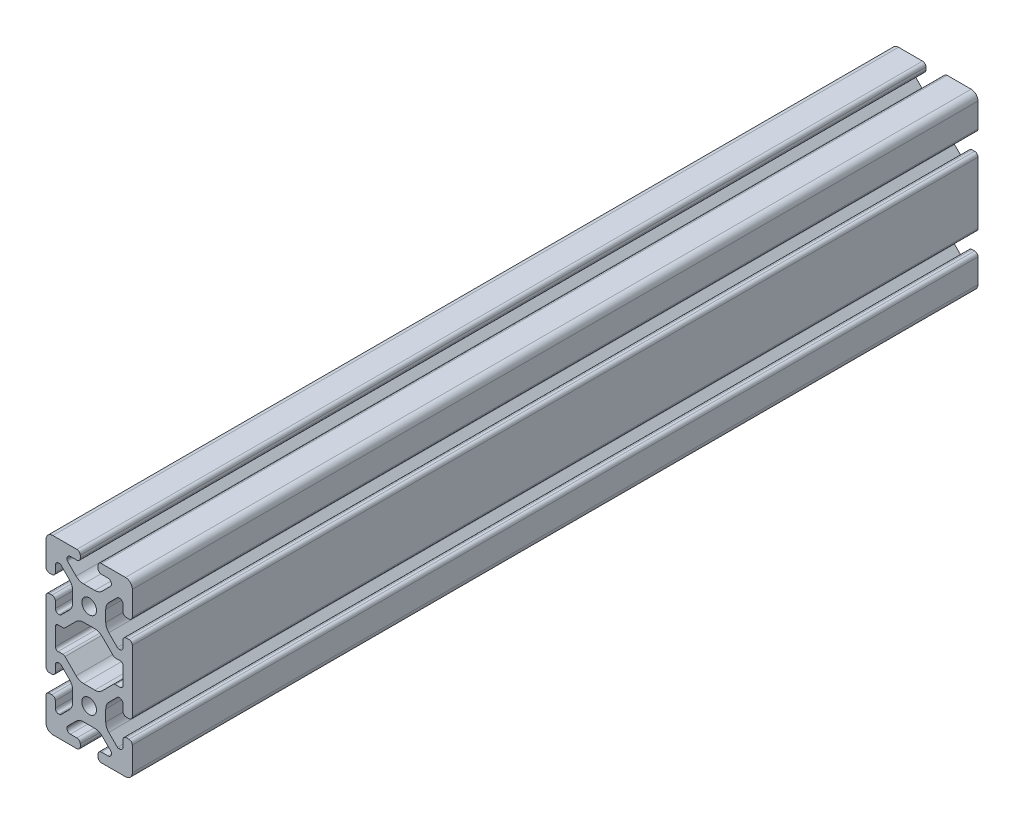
SolidWorks part; units mm, degrees
ref_plane "Front Plane" through (0, 0, 0) normal (0, 0, 1) x (1, 0, 0)
ref_plane "Top Plane" through (0, 0, 0) normal (0, 1, 0) x (1, 0, 0)
ref_plane "Right Plane" through (0, 0, 0) normal (1, 0, 0) x (0, 0, -1)
ref_plane "Plane1" through (0, 0, -3048) normal (0, 0, -1) x (-1, 0, 0)
sketch "Sketch1" plane through (0, 0, -3048) normal (0, 0, -1) x (-1, 0, 0)
  line L0 (14.41, 14.6586) -> (12.13, 14.6586)
  line L1 (11.1794, 14.2308) -> (6.0551, 9.1098)
  line L2 (2.6153, 7.685) -> (-2.6153, 7.685)
  line L3 (-6.0551, 9.1098) -> (-11.232, 14.2867)
  line L4 (-12.13, 14.6586) -> (-14.41, 14.6586)
  line L5 (-15.68, 15.9286) -> (-15.68, 24.0714)
  line L6 (-14.41, 25.3414) -> (-12.13, 25.3414)
  line L7 (-11.232, 25.7133) -> (-6.0551, 30.8902)
  line L8 (-2.6153, 32.315) -> (2.6176, 32.315)
  line L9 (6.0573, 30.8902) -> (11.1842, 25.7634)
  line L10 (12.13, 25.3414) -> (14.41, 25.3414)
  line L11 (15.68, 24.0714) -> (15.68, 15.9286)
  line L12 (16.83, 60) -> (5.6904, 60)
  line L13 (4.1204, 58.43) -> (4.1204, 57.25)
  line L14 (5.6904, 55.68) -> (8.7154, 55.68)
  line L15 (10.2854, 54.11) -> (10.2854, 53.6549)
  line L16 (10.0628, 53.1175) -> (6.0551, 49.1098)
  line L17 (2.6153, 47.685) -> (-2.6153, 47.685)
  line L18 (-6.0551, 49.1098) -> (-10.0628, 53.1175)
  line L19 (-10.2854, 53.6549) -> (-10.2854, 54.11)
  line L20 (-8.7154, 55.68) -> (-5.6904, 55.68)
  line L21 (-4.1204, 57.25) -> (-4.1204, 58.43)
  line L22 (-5.6904, 60) -> (-16.83, 60)
  line L23 (-20, 56.83) -> (-20, 45.6904)
  line L24 (-18.43, 44.1204) -> (-17.25, 44.1204)
  line L25 (-15.68, 45.6904) -> (-15.68, 48.7154)
  line L26 (-14.11, 50.2854) -> (-13.6527, 50.2854)
  line L27 (-13.1153, 50.0628) -> (-9.1098, 46.0573)
  line L28 (-7.685, 42.6176) -> (-7.685, 37.3847)
  line L29 (-9.1098, 33.9449) -> (-13.1175, 29.9372)
  line L30 (-13.6549, 29.7146) -> (-14.11, 29.7146)
  line L31 (-15.68, 31.2846) -> (-15.68, 34.3096)
  line L32 (-17.25, 35.8796) -> (-18.43, 35.8796)
  line L33 (-20, 34.3096) -> (-20, 5.6904)
  line L34 (-18.43, 4.1204) -> (-17.25, 4.1204)
  line L35 (-15.68, 5.6904) -> (-15.68, 8.7154)
  line L36 (-14.11, 10.2854) -> (-13.6549, 10.2854)
  line L37 (-13.1175, 10.0628) -> (-9.1098, 6.0551)
  line L38 (-7.685, 2.6153) -> (-7.685, -2.6153)
  line L39 (-9.1098, -6.0551) -> (-13.1175, -10.0628)
  line L40 (-13.6549, -10.2854) -> (-14.11, -10.2854)
  line L41 (-15.68, -8.7154) -> (-15.68, -5.6904)
  line L42 (-17.25, -4.1204) -> (-18.43, -4.1204)
  line L43 (-20, -5.6904) -> (-20, -16.83)
  line L44 (-16.83, -20) -> (-5.6904, -20)
  line L45 (-4.1204, -18.43) -> (-4.1204, -17.25)
  line L46 (-5.6904, -15.68) -> (-8.7154, -15.68)
  line L47 (-10.2854, -14.11) -> (-10.2854, -13.6549)
  line L48 (-10.0628, -13.1175) -> (-6.0551, -9.1098)
  line L49 (-2.6153, -7.685) -> (2.6153, -7.685)
  line L50 (6.0551, -9.1098) -> (10.0628, -13.1175)
  line L51 (10.2854, -13.6549) -> (10.2854, -14.11)
  line L52 (8.7154, -15.68) -> (5.6904, -15.68)
  line L53 (4.1204, -17.25) -> (4.1204, -18.43)
  line L54 (5.6904, -20) -> (16.83, -20)
  line L55 (20, -16.83) -> (20, -5.6904)
  line L56 (18.43, -4.1204) -> (17.25, -4.1204)
  line L57 (15.68, -5.6904) -> (15.68, -8.7154)
  line L58 (14.11, -10.2854) -> (13.6549, -10.2854)
  line L59 (13.1175, -10.0628) -> (9.1098, -6.0551)
  line L60 (7.685, -2.6153) -> (7.685, 2.6153)
  line L61 (9.1098, 6.0551) -> (13.1175, 10.0628)
  line L62 (13.6549, 10.2854) -> (14.11, 10.2854)
  line L63 (15.68, 8.7154) -> (15.68, 5.6904)
  line L64 (17.25, 4.1204) -> (18.43, 4.1204)
  line L65 (20, 5.6904) -> (20, 34.3096)
  line L66 (18.43, 35.8796) -> (17.25, 35.8796)
  line L67 (15.68, 34.3096) -> (15.68, 31.2846)
  line L68 (14.11, 29.7146) -> (13.6549, 29.7146)
  line L69 (13.1175, 29.9372) -> (9.1098, 33.9449)
  line L70 (7.685, 37.3847) -> (7.685, 42.6153)
  line L71 (9.1098, 46.0551) -> (13.1175, 50.0628)
  line L72 (13.6549, 50.2854) -> (14.11, 50.2854)
  line L73 (15.68, 48.7154) -> (15.68, 45.6904)
  line L74 (17.25, 44.1204) -> (18.43, 44.1204)
  line L75 (20, 45.6904) -> (20, 56.83)
  arc A0 (15.68, 15.9286) -> (14.41, 14.6586) centre (14.41, 15.9286) cw
  arc A1 (12.13, 14.6586) -> (11.1794, 14.2308) centre (12.13, 13.3886) ccw
  arc A2 (6.0551, 9.1098) -> (2.6153, 7.685) centre (2.6153, 12.5496) cw
  arc A3 (-2.6153, 7.685) -> (-6.0551, 9.1098) centre (-2.6153, 12.5496) cw
  arc A4 (-11.232, 14.2867) -> (-12.13, 14.6586) centre (-12.13, 13.3886) ccw
  arc A5 (-14.41, 14.6586) -> (-15.68, 15.9286) centre (-14.41, 15.9286) cw
  arc A6 (-15.68, 24.0714) -> (-14.41, 25.3414) centre (-14.41, 24.0714) cw
  arc A7 (-12.13, 25.3414) -> (-11.232, 25.7133) centre (-12.13, 26.6114) ccw
  arc A8 (-6.0551, 30.8902) -> (-2.6153, 32.315) centre (-2.6153, 27.4504) cw
  arc A9 (2.6176, 32.315) -> (6.0573, 30.8902) centre (2.6176, 27.4504) cw
  arc A10 (11.1842, 25.7634) -> (12.13, 25.3414) centre (12.13, 26.6123) ccw
  arc A11 (14.41, 25.3414) -> (15.68, 24.0714) centre (14.41, 24.0714) cw
  circle A12 centre (0, 0) radius 3.405
  circle A13 centre (0, 40) radius 3.405
  arc A14 (5.6904, 60) -> (4.1204, 58.43) centre (5.6904, 58.43) ccw
  arc A15 (4.1204, 57.25) -> (5.6904, 55.68) centre (5.6904, 57.25) ccw
  arc A16 (8.7154, 55.68) -> (10.2854, 54.11) centre (8.7154, 54.11) cw
  arc A17 (10.2854, 53.6549) -> (10.0628, 53.1175) centre (9.5254, 53.6549) cw
  arc A18 (6.0551, 49.1098) -> (2.6153, 47.685) centre (2.6153, 52.5496) cw
  arc A19 (-2.6153, 47.685) -> (-6.0551, 49.1098) centre (-2.6153, 52.5496) cw
  arc A20 (-10.0628, 53.1175) -> (-10.2854, 53.6549) centre (-9.5254, 53.6549) cw
  arc A21 (-10.2854, 54.11) -> (-8.7154, 55.68) centre (-8.7154, 54.11) cw
  arc A22 (-5.6904, 55.68) -> (-4.1204, 57.25) centre (-5.6904, 57.25) ccw
  arc A23 (-4.1204, 58.43) -> (-5.6904, 60) centre (-5.6904, 58.43) ccw
  arc A24 (-16.83, 60) -> (-20, 56.83) centre (-16.83, 56.83) ccw
  arc A25 (-20, 45.6904) -> (-18.43, 44.1204) centre (-18.43, 45.6904) ccw
  arc A26 (-17.25, 44.1204) -> (-15.68, 45.6904) centre (-17.25, 45.6904) ccw
  arc A27 (-15.68, 48.7154) -> (-14.11, 50.2854) centre (-14.11, 48.7154) cw
  arc A28 (-13.6527, 50.2854) -> (-13.1153, 50.0628) centre (-13.6527, 49.5254) cw
  arc A29 (-9.1098, 46.0573) -> (-7.685, 42.6176) centre (-12.5496, 42.6176) cw
  arc A30 (-7.685, 37.3847) -> (-9.1098, 33.9449) centre (-12.5496, 37.3847) cw
  arc A31 (-13.1175, 29.9372) -> (-13.6549, 29.7146) centre (-13.6549, 30.4746) cw
  arc A32 (-14.11, 29.7146) -> (-15.68, 31.2846) centre (-14.11, 31.2846) cw
  arc A33 (-15.68, 34.3096) -> (-17.25, 35.8796) centre (-17.25, 34.3096) ccw
  arc A34 (-18.43, 35.8796) -> (-20, 34.3096) centre (-18.43, 34.3096) ccw
  arc A35 (-20, 5.6904) -> (-18.43, 4.1204) centre (-18.43, 5.6904) ccw
  arc A36 (-17.25, 4.1204) -> (-15.68, 5.6904) centre (-17.25, 5.6904) ccw
  arc A37 (-15.68, 8.7154) -> (-14.11, 10.2854) centre (-14.11, 8.7154) cw
  arc A38 (-13.6549, 10.2854) -> (-13.1175, 10.0628) centre (-13.6549, 9.5254) cw
  arc A39 (-9.1098, 6.0551) -> (-7.685, 2.6153) centre (-12.5496, 2.6153) cw
  arc A40 (-7.685, -2.6153) -> (-9.1098, -6.0551) centre (-12.5496, -2.6153) cw
  arc A41 (-13.1175, -10.0628) -> (-13.6549, -10.2854) centre (-13.6549, -9.5254) cw
  arc A42 (-14.11, -10.2854) -> (-15.68, -8.7154) centre (-14.11, -8.7154) cw
  arc A43 (-15.68, -5.6904) -> (-17.25, -4.1204) centre (-17.25, -5.6904) ccw
  arc A44 (-18.43, -4.1204) -> (-20, -5.6904) centre (-18.43, -5.6904) ccw
  arc A45 (-20, -16.83) -> (-16.83, -20) centre (-16.83, -16.83) ccw
  arc A46 (-5.6904, -20) -> (-4.1204, -18.43) centre (-5.6904, -18.43) ccw
  arc A47 (-4.1204, -17.25) -> (-5.6904, -15.68) centre (-5.6904, -17.25) ccw
  arc A48 (-8.7154, -15.68) -> (-10.2854, -14.11) centre (-8.7154, -14.11) cw
  arc A49 (-10.2854, -13.6549) -> (-10.0628, -13.1175) centre (-9.5254, -13.6549) cw
  arc A50 (-6.0551, -9.1098) -> (-2.6153, -7.685) centre (-2.6153, -12.5496) cw
  arc A51 (2.6153, -7.685) -> (6.0551, -9.1098) centre (2.6153, -12.5496) cw
  arc A52 (10.0628, -13.1175) -> (10.2854, -13.6549) centre (9.5254, -13.6549) cw
  arc A53 (10.2854, -14.11) -> (8.7154, -15.68) centre (8.7154, -14.11) cw
  arc A54 (5.6904, -15.68) -> (4.1204, -17.25) centre (5.6904, -17.25) ccw
  arc A55 (4.1204, -18.43) -> (5.6904, -20) centre (5.6904, -18.43) ccw
  arc A56 (16.83, -20) -> (20, -16.83) centre (16.83, -16.83) ccw
  arc A57 (20, -5.6904) -> (18.43, -4.1204) centre (18.43, -5.6904) ccw
  arc A58 (17.25, -4.1204) -> (15.68, -5.6904) centre (17.25, -5.6904) ccw
  arc A59 (15.68, -8.7154) -> (14.11, -10.2854) centre (14.11, -8.7154) cw
  arc A60 (13.6549, -10.2854) -> (13.1175, -10.0628) centre (13.6549, -9.5254) cw
  arc A61 (9.1098, -6.0551) -> (7.685, -2.6153) centre (12.5496, -2.6153) cw
  arc A62 (7.685, 2.6153) -> (9.1098, 6.0551) centre (12.5496, 2.6153) cw
  arc A63 (13.1175, 10.0628) -> (13.6549, 10.2854) centre (13.6549, 9.5254) cw
  arc A64 (14.11, 10.2854) -> (15.68, 8.7154) centre (14.11, 8.7154) cw
  arc A65 (15.68, 5.6904) -> (17.25, 4.1204) centre (17.25, 5.6904) ccw
  arc A66 (18.43, 4.1204) -> (20, 5.6904) centre (18.43, 5.6904) ccw
  arc A67 (20, 34.3096) -> (18.43, 35.8796) centre (18.43, 34.3096) ccw
  arc A68 (17.25, 35.8796) -> (15.68, 34.3096) centre (17.25, 34.3096) ccw
  arc A69 (15.68, 31.2846) -> (14.11, 29.7146) centre (14.11, 31.2846) cw
  arc A70 (13.6549, 29.7146) -> (13.1175, 29.9372) centre (13.6549, 30.4746) cw
  arc A71 (9.1098, 33.9449) -> (7.685, 37.3847) centre (12.5496, 37.3847) cw
  arc A72 (7.685, 42.6153) -> (9.1098, 46.0551) centre (12.5496, 42.6153) cw
  arc A73 (13.1175, 50.0628) -> (13.6549, 50.2854) centre (13.6549, 49.5254) cw
  arc A74 (14.11, 50.2854) -> (15.68, 48.7154) centre (14.11, 48.7154) cw
  arc A75 (15.68, 45.6904) -> (17.25, 44.1204) centre (17.25, 45.6904) ccw
  arc A76 (18.43, 44.1204) -> (20, 45.6904) centre (18.43, 45.6904) ccw
  arc A77 (20, 56.83) -> (16.83, 60) centre (16.83, 56.83) ccw
extrude "Boss-Extrude1" add sketch "Sketch1" against normal blind 3048
ref_plane "2.5 ft cut1" through (0, 0, -762) normal (0, 0, 1) x (1, 0, 0)
ref_plane "2.5 ft cut2" through (0, 0, -1524) normal (0, 0, 1) x (1, 0, 0)
ref_plane "16.14 in cut3" through (0, 0, -1933.956) normal (0, 0, 1) x (1, 0, 0)
ref_plane "13 in cut4" through (0, 0, -2264.156) normal (0, 0, 1) x (1, 0, 0)
ref_plane "midplane cut5" through (0, 0, -2656.078) normal (0, 0, 1) x (1, 0, 0)
sketch "Sketch26" plane through (0, 0, -762) normal (0, 0, 1) x (1, 0, 0)
  line L0 (-20, -20.8001) -> (20, -20.8001)
  line L1 (-20, -20.8001) -> (-20, 60)
  line L2 (-20, 60) -> (20, 60)
  line L3 (20, -20.8001) -> (20, 60)
sketch "Sketch33" plane through (0, 0, -1524) normal (0, 0, 1) x (1, 0, 0)
  line L5 (-20, 60) -> (20, 60)
  line L6 (-20, 60) -> (-20, -20.8001)
  line L7 (-20, -20.8001) -> (20, -20.8001)
  line L8 (20, 60) -> (20, -20.8001)
sketch "Sketch41" plane through (0, 0, -1933.956) normal (0, 0, 1) x (1, 0, 0)
  line L0 (-20, -20.8001) -> (20, -20.8001)
  line L1 (-20, -20.8001) -> (-20, 60)
  line L2 (-20, 60) -> (20, 60)
  line L3 (20, -20.8001) -> (20, 60)
sketch "Sketch50" plane through (0, 0, -2264.156) normal (0, 0, 1) x (1, 0, 0)
  line L0 (-20, -20.8001) -> (20, -20.8001)
  line L1 (-20, -20.8001) -> (-20, 60)
  line L2 (-20, 60) -> (20, 60)
  line L3 (20, -20.8001) -> (20, 60)
sketch "Sketch51" plane through (0, 0, -2656.078) normal (0, 0, 1) x (1, 0, 0)
  line L1 (-20, 60) -> (20, 60)
  line L2 (-20, 60) -> (-20, -20.8001)
  line L3 (-20, -20.8001) -> (20, -20.8001)
  line L4 (20, 60) -> (20, -20.8001)
extrude "Cut-Extrude1" cut sketch "Sketch26" along normal through all
extrude "Cut-Extrude2" cut sketch "Sketch33" along normal through all
extrude "Cut-Extrude3" cut sketch "Sketch41" along normal through all
extrude "Cut-Extrude4" cut sketch "Sketch50" along normal through all
extrude "Cut-Extrude5" cut sketch "Sketch51" along normal through all
